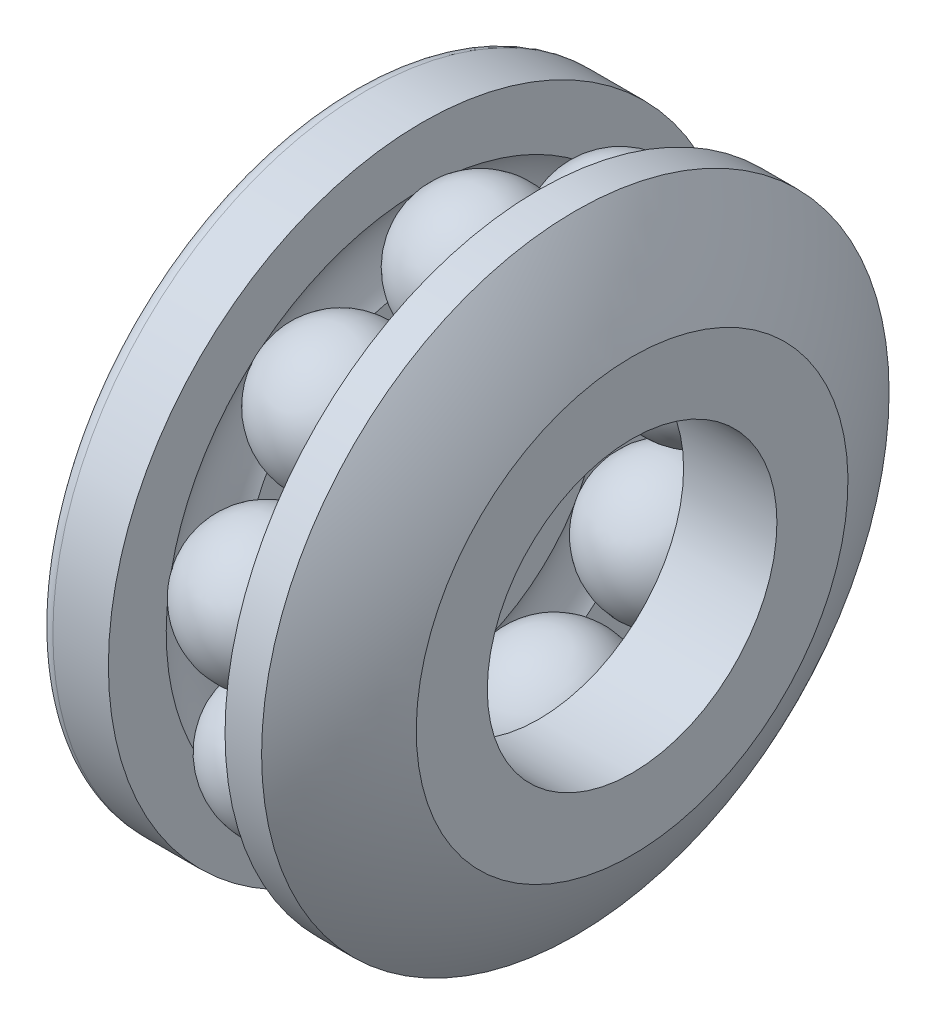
SolidWorks part; units mm, degrees
ref_plane "Front" through (0, 0, 0) normal (0, 0, 1) x (1, 0, 0)
ref_plane "Top" through (0, 0, 0) normal (0, 1, 0) x (1, 0, 0)
ref_plane "Right" through (0, 0, 0) normal (1, 0, 0) x (0, 0, -1)
other "Configuration Table"
sketch "Sketch1" plane through (0, 0, 0) normal (0, 0, 1) x (1, 0, 0)
  line L0 (-5.3167, 0) -> (-13.8167, 0) construction
  line L1 (-5.3167, 5) -> (-5.3167, 13)
  line L2 (-5.3167, 13) -> (-2.4167, 13)
  line L3 (-2.4167, 13) -> (-2.4167, 5)
  line L4 (-2.4167, 5) -> (-5.3167, 5)
  line L5 (-13.8167, 13) -> (-13.8167, -10.6089) construction
  line L6 (2.4167, 13) -> (2.4167, 6)
  line L7 (2.4167, 6) -> (6.2833, 6)
  line L8 (6.2833, 6) -> (6.2833, 8.9437)
  line L9 (2.4167, 13) -> (3.9316, 13)
  line L10 (-2.4167, 5) -> (2.4167, 5)
  line L11 (-5.3167, 5) -> (-5.3167, 4.4)
  circle A0 centre (0, 9) radius 2.9
  arc A1 (6.2833, 8.9437) -> (3.9316, 13) centre (-13.8167, 0) ccw
  point P18 (0, 5)
revolve "Revolve1" add sketch "Sketch1" angle 360 about L0
sketch "Sketch2" plane through (0, 0, 0) normal (0, 0, 1) x (1, 0, 0)
  line L0 (0, 11.91) -> (0, 6.09)
  line L1 (0, 6.09) -> (0, 13.9953) construction
  arc A0 (0, 11.91) -> (0, 6.09) centre (0, 9) ccw
revolve "Revolve2" add sketch "Sketch2" angle 360 about L1
sketch "Sketch3" plane through (0, 0, 0) normal (0, 0, 1) x (1, 0, 0)
  line L0 (6.2833, 6) -> (6.2833, 8.9437) construction
  line L1 (2.4167, 6) -> (6.2833, 6) construction
  line L2 (2.4167, 13) -> (3.9316, 13) construction
  line L3 (2.4167, 13) -> (2.4167, 6) construction
  line L4 (6.2833, 6) -> (6.2833, 8.9437)
  line L5 (2.4167, 6) -> (6.2833, 6)
  line L6 (2.4167, 13) -> (3.9316, 13)
  line L7 (2.4167, 13) -> (2.4167, 10.603)
  line L8 (2.4167, 7.397) -> (2.4167, 6)
  arc A0 (6.2833, 8.9437) -> (3.9316, 13) centre (-13.8167, 0) ccw construction
  circle A1 centre (0, 9) radius 2.9 construction
  arc A2 (6.2833, 8.9437) -> (3.9316, 13) centre (-13.8167, 0) ccw
  arc A3 (2.4167, 7.397) -> (2.4167, 10.603) centre (0, 9) ccw
revolve "Revolve3" add sketch "Sketch3" angle 360 about axis through (-5.3167, 0, 0) along (-1, 0, 0)
fillet "Fillet2" radius 0.6 2 edges at (-5.3167, 5, 0) (-5.3167, 13, 0)
pattern_circular "Circular-Pattern1" count 9 over 360 about axis through (0, 0, 0) along (1, 0, 0) of "Revolve2"
equation "\"1/4dt@Sketch1\" = \"dt@Sketch1\" / 4"
equation "\"qj@Sketch1\" = \"dt@Sketch1\" / 2"
equation "\"zj@Sketch1\" =  ( \"dd1@Sketch1\"  + \"xd@Sketch1\" )  / 2"
equation "\"D2@Sketch1\" = \"dt@Sketch1\" / 3"
equation "\"qj@Sketch2\" = \"qj@Sketch1\"+0.02"
equation "\"D1@Fillet2\" = \"xr@Sketch1\""
equation "\"D1@Circular-Pattern1\" = int( 3.14159265 / atn(( \"qj@Sketch1\"/ 2) / sqr( \"zj@Sketch1\"* \"zj@Sketch1\"/4 - ( \"qj@Sketch1\"/ 2) *  ( \"qj@Sketch1\"/ 2))))"
